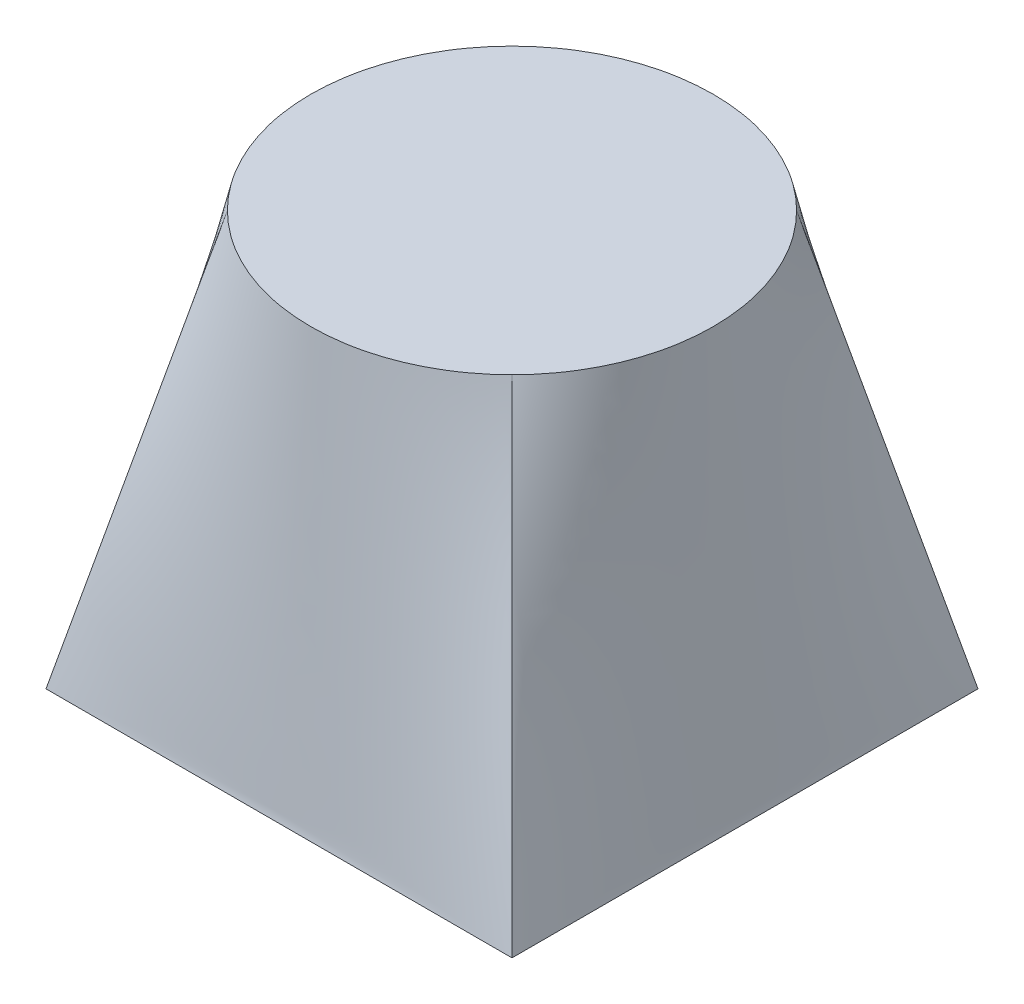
SolidWorks part; units mm, degrees
ref_plane "Front Plane" through (0, 0, 0) normal (0, 0, 1) x (1, 0, 0)
ref_plane "Top Plane" through (0, 0, 0) normal (0, 1, 0) x (1, 0, 0)
ref_plane "Right Plane" through (0, 0, 0) normal (1, 0, 0) x (0, 0, -1)
sketch "Sketch3" plane through (0, 0, 0) normal (0, 1, 0) x (1, 0, 0)
  line L0 (135.2318, 101.7404) -> (-21.3763, 101.7404)
  line L1 (104.7518, 71.2604) -> (9.1037, 71.2604) construction
  line L2 (104.7518, 71.2604) -> (104.7518, -24.3877) construction
  line L3 (104.7518, -24.3877) -> (9.1037, -24.3877) construction
  line L4 (9.1037, 71.2604) -> (9.1037, -24.3877) construction
  line L5 (-21.3763, 101.7404) -> (-21.3763, -54.8677)
  line L6 (135.2318, -54.8677) -> (-21.3763, -54.8677)
  line L7 (135.2318, 101.7404) -> (135.2318, -54.8677)
  dimension "D1" = 30.48
ref_plane "Plane1" through (0, 139.2418, 0) normal (0, 1, 0) x (-1, 0, 0)
sketch "Sketch4" plane through (0, 139.2418, 0) normal (0, 1, 0) x (-1, 0, 0)
  arc A0 (-9.1037, 24.3877) -> (-104.7518, 24.3877) centre (-56.9278, -23.4364) ccw
  arc A1 (-104.7518, 24.3877) -> (-104.7518, -71.2604) centre (-56.9278, -23.4364) ccw
  arc A2 (-104.7518, -71.2604) -> (-9.1037, -71.2604) centre (-56.9278, -23.4364) ccw
  arc A3 (-9.1037, -71.2604) -> (-9.1037, 24.3877) centre (-56.9278, -23.4364) ccw
loft "Loft1" add profiles "Sketch3", "Sketch4"
